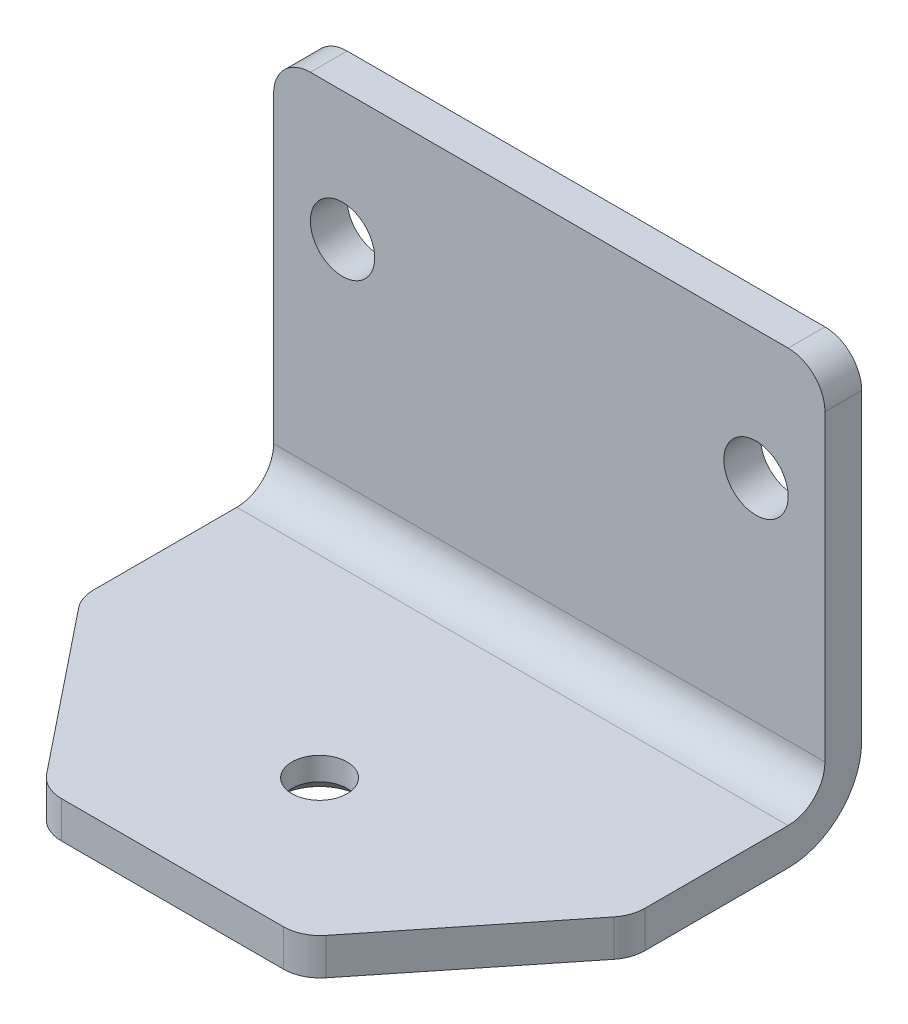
SolidWorks part; units mm, degrees
ref_plane "Face" through (0, 0, 0) normal (0, 0, 1) x (1, 0, 0)
ref_plane "Dessus" through (0, 0, 0) normal (0, 1, 0) x (1, 0, 0)
ref_plane "Droite" through (0, 0, 0) normal (1, 0, 0) x (0, 0, -1)
sketch "Esquisse2" plane through (0, 0, 0) normal (1, 0, 0) x (0, 0, -1)
  line L0 (0, 0) -> (0, 45)
  line L1 (0, 0) -> (-45, 0)
  dimension "D1" = 45
  dimension "D2" = 45
extrude "Extru.-Mince1" add sketch "Esquisse2" along normal mid plane 60 thin
fillet "Congé1" radius 4
fillet "Congé2" radius 8
fillet "Congé3" radius 4
chamfer "Chanfrein1" distance 20 distance2 16
fillet "Congé4" radius 4
sketch "Esquisse3" plane through (0, 0, 4) normal (0, 0, 1) x (1, 0, 0)
  line L0 (-30, 41) -> (-30, 8) construction
  line L1 (26, 45) -> (-26, 45) construction
  circle A0 centre (-22.5, 31) radius 3.5
  dimension "D1" = 7
  dimension "D2" = 7.5
  dimension "D3" = 14
extrude "Enlèv. mat.-Extru.1" cut sketch "Esquisse3" against normal through all
pattern_linear "Répétition linéaire1" count 2 spacing 45
sketch "Esquisse4" plane through (0, 4, 0) normal (0, 1, 0) x (-1, 0, 0)
  line L0 (-12.0775, 45) -> (12.0775, 45) construction
  circle A0 centre (0, 29) radius 3
  dimension "D1" = 6
  dimension "D2" = 16
extrude "Enlèv. mat.-Extru.2" cut sketch "Esquisse4" against normal through all
sketch "Esquisse6" plane through (0, 0, 29) normal (0, 0, -1) x (-1, 0, 0)
  line L0 (-3, 1.5) -> (-4.5, 0) construction
  line L1 (-3, 1.5) -> (-4.5, 0)
  line L2 (3, 1.5) -> (-3, 1.5) construction
  line L3 (0, 1.5) -> (-3, 1.5)
  line L4 (0, 0) -> (0, 2.2355) construction
  line L5 (0, 1.5) -> (0, 0)
  line L6 (0, 0) -> (-4.5, 0)
revolve "Enlèvement de matière-Révolution1" cut sketch "Esquisse6" angle 360 about L4
